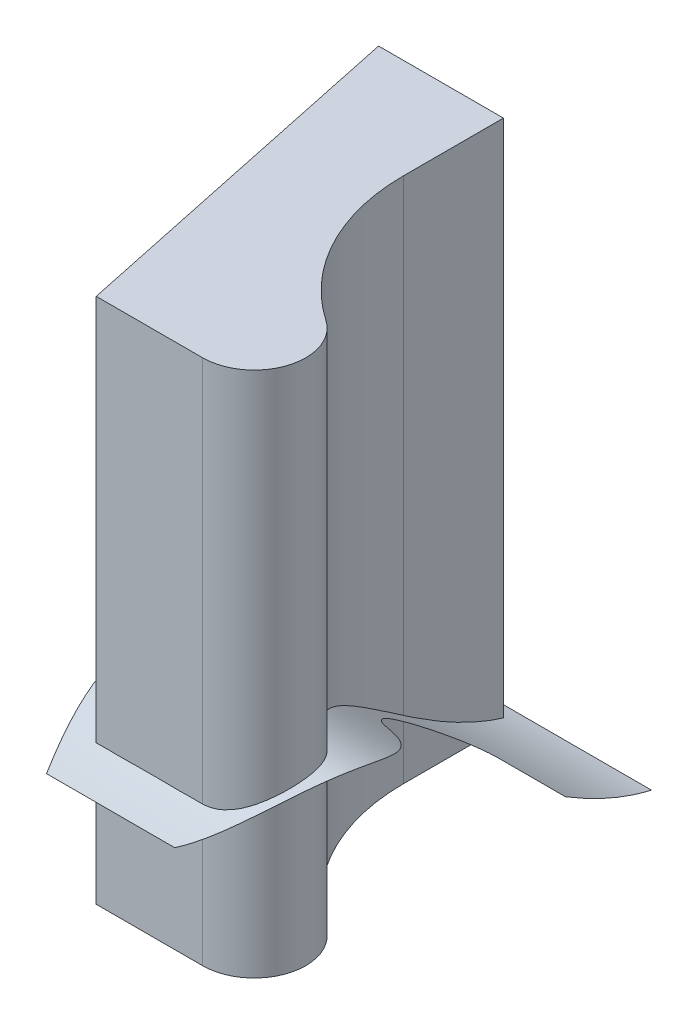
SolidWorks part; units mm, degrees
ref_plane "Front Plane" through (0, 0, 0) normal (0, 0, 1) x (1, 0, 0)
ref_plane "Top Plane" through (0, 0, 0) normal (0, 1, 0) x (1, 0, 0)
ref_plane "Right Plane" through (0, 0, 0) normal (1, 0, 0) x (0, 0, -1)
sketch "Sketch1" plane through (0, 0, 0) normal (1, 0, 0) x (0, 0, -1)
  spline S0 degree 3 poles (-50.2564, -4.6182) (-13.8908, 81.4125) (14.6119, -15.5554) (62.2093, 1.6299) knots 0 0 0 0 1 1 1 1
surface "Surface-Extrude1" sketch "Sketch1" parameters "D1"=101.6
ref_plane "Plane1" through (0, 96.52, 0) normal (0, 1, 0) x (1, 0, 0)
sketch "Sketch2" plane through (0, 96.52, 0) normal (0, 1, 0) x (1, 0, 0)
  line L0 (-22.6573, 42.4703) -> (32.1699, 42.4703)
  line L1 (32.1699, 42.4703) -> (32.1699, 25.8664)
  line L2 (32.1699, 25.8664) -> (19.5441, 25.8664)
  line L3 (17.4686, -34.8413) -> (-7.2642, -34.8413)
  line L4 (-7.2642, -34.8413) -> (-22.6573, 42.4703)
  arc A0 (19.5441, 25.8664) -> (16.085, 7.533) centre (19.5441, 16.3734) ccw
  arc A1 (16.085, 7.533) -> (17.4686, -34.8413) centre (7.6784, -13.9512) cw
surface "Surface-Trim1"
sketch "Sketch3" plane through (0, 0, 0) normal (0, 1, 0) x (1, 0, 0)
  line L0 (-17.4067, 39.3793) -> (-2.8132, -29.6965)
  line L1 (-2.8132, -29.6965) -> (17.7258, -29.6965)
  line L2 (6.688, 20.059) -> (6.688, 39.3793)
  line L3 (6.688, 39.3793) -> (-17.4067, 39.3793)
  arc A0 (17.7258, -29.6965) -> (23.347, -11.5357) centre (17.7258, -19.7462) ccw
  arc A1 (23.347, -11.5357) -> (6.688, 20.059) centre (44.978, 20.059) cw
extrude "Boss-Extrude2" add sketch "Sketch3" along normal blind 101.6
